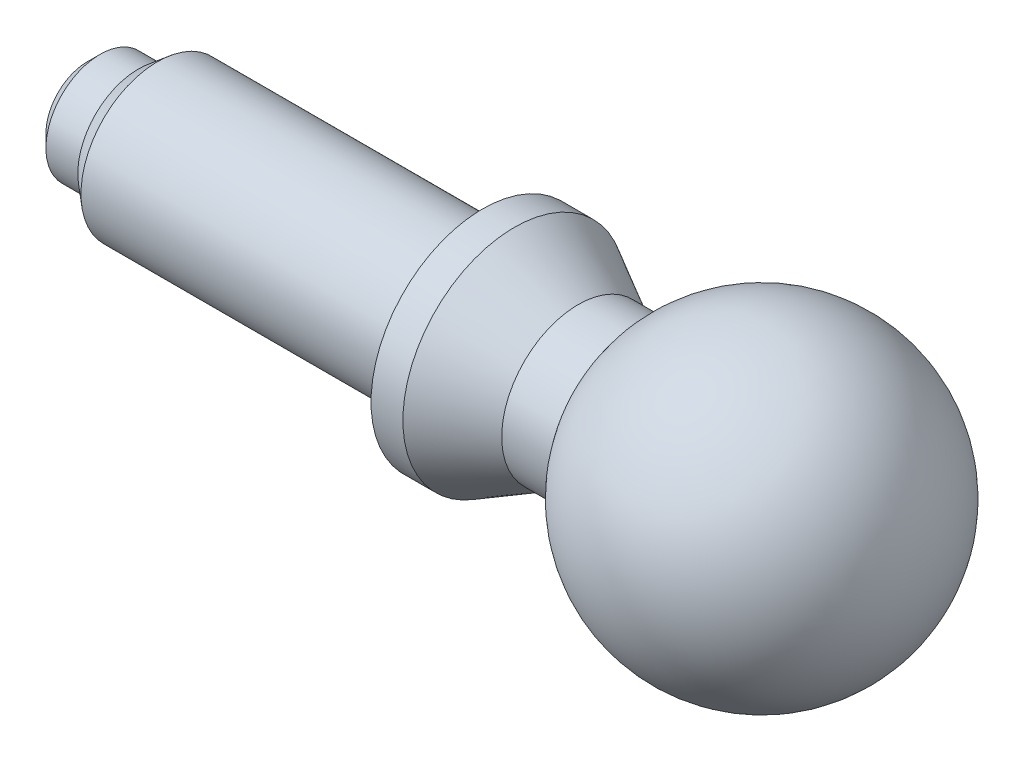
SolidWorks part; units mm, degrees
ref_plane "face" through (0, 0, 0) normal (0, 0, 1) x (1, 0, 0)
ref_plane "dessus" through (0, 0, 0) normal (0, 1, 0) x (1, 0, 0)
ref_plane "profil" through (0, 0, 0) normal (1, 0, 0) x (0, 0, -1)
sketch "Esquisse1" plane through (0, 0, 0) normal (0, 0, 1) x (1, 0, 0)
  line L0 (0, 0) -> (0, 6.5)
  line L1 (0, 6.5) -> (2, 8.5)
  line L2 (2, 8.5) -> (8, 8.5)
  line L3 (8, 8.5) -> (8, 9.5)
  line L4 (8, 9.5) -> (11, 12)
  line L5 (11, 12) -> (62, 12)
  line L6 (62, 12) -> (62, 17.5)
  line L7 (62, 17.5) -> (67, 17.5)
  line L8 (67, 17.5) -> (77, 12)
  line L9 (77, 12) -> (85, 12)
  line L11 (129.7846, 0) -> (0, 0)
  line L12 (134.4394, 0) -> (-13.4051, 0) construction
  arc A0 (129.7846, 0) -> (85, 12) centre (105.7846, 0) ccw
  dimension "D1" = 6.5
  dimension "D2" = 2
  dimension "D3" = 2
  dimension "D4" = 6
  dimension "D5" = 1
  dimension "D6" = 3
  dimension "D7" = 2.5
  dimension "D8" = 51
  dimension "D9" = 5.5
  dimension "D10" = 5
  dimension "D11" = 10
  dimension "D12" = 5.5
  dimension "D13" = 8
  dimension "D14" = 24
  dimension "D15" = 12
revolve "Base-Révolution" add sketch "Esquisse1" angle 360 about L12
